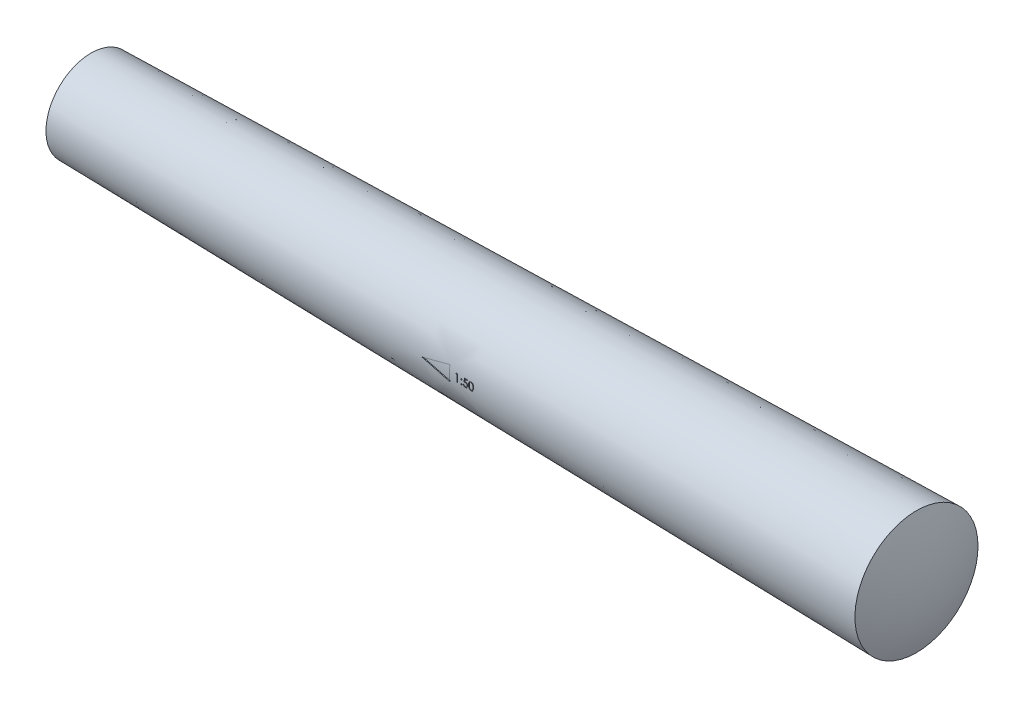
SolidWorks part; units mm, degrees
ref_plane "Front Plane" through (0, 0, 0) normal (0, 0, 1) x (1, 0, 0)
ref_plane "Top Plane" through (0, 0, 0) normal (0, 1, 0) x (1, 0, 0)
ref_plane "Right Plane" through (0, 0, 0) normal (1, 0, 0) x (0, 0, -1)
sketch "Sketch1" plane through (0, 0, 0) normal (1, 0, 0) x (0, 0, -1)
  circle A0 centre (0, 0) radius 6
  dimension "D1" = 12
extrude "Extrude1" add sketch "Sketch1" along normal mid plane 110
draft "Draft1" type of draft neutral plane draft angle 1.146 faces to draft 1 parameters "D1"=1.146
sketch "Sketch2" plane through (0, 0, 0) normal (0, 0, 1) x (1, 0, 0)
  line L0 (-55, 0) -> (-55, 6)
  line L1 (-55, 6) -> (-55, -6) construction
  line L2 (-55, 0) -> (-56.6, 0)
  line L3 (-56.6, 0) -> (-56.6, -7.1) construction
  line L4 (55, 0) -> (55, 8.2001)
  line L5 (55, -8.2001) -> (55, 8.2001) construction
  line L6 (55, 0) -> (56.6, 0)
  line L7 (56.6, 0) -> (56.6, -7.1) construction
  line L8 (-55, -6) -> (55, -8.2001) construction
  arc A0 (-56.6, 0) -> (-55, 6) centre (-44.55, 0) cw
  arc A1 (56.6, 0) -> (55, 8.2001) centre (34.7871, 0) ccw
  point P14 (0, -7.1)
revolve "Revolve1" add sketch "Sketch2" angle 360 about L2
sketch "Sketch5" plane through (0, 0, 0) normal (0, 0, 1) x (1, 0, 0)
  line L0 (0, 7.1) -> (0, -7.1) construction
  line L1 (55, 8.2001) -> (-55, 6) construction
  line L2 (-55, -6) -> (55, -8.2001) construction
ref_plane "Plane2" through (0, 0, 0) normal (-0.02, 0, 0.9998) x (0.9998, 0, 0.02)
sketch "Sketch6" plane through (0, 0, 0) normal (-0.02, 0, 0.9998) x (0.9998, 0, 0.02)
  line L0 (0, 0) -> (0, 1)
  line L1 (0, 7.1) -> (0, -7.1) construction
  line L2 (0, 1) -> (-3.7321, 0)
  line L3 (-3.7321, 0) -> (0, -1)
  line L4 (0, -1) -> (0, 0)
  line L5 (0, -0.5) -> (4, -0.5) construction
  text T0 "1:50" font "Century Gothic" height 1
  dimension "D1" = 2
  dimension "D2" = 30
  dimension "D3" = 4
wrap "Wrap2" sketch "Sketch6" wrap type deboss source sketch "Sketch6" thickness 0.1 parameters "D1"=0.1
equation "\"D2@Sketch2\" = \"D1@Sketch2\""
